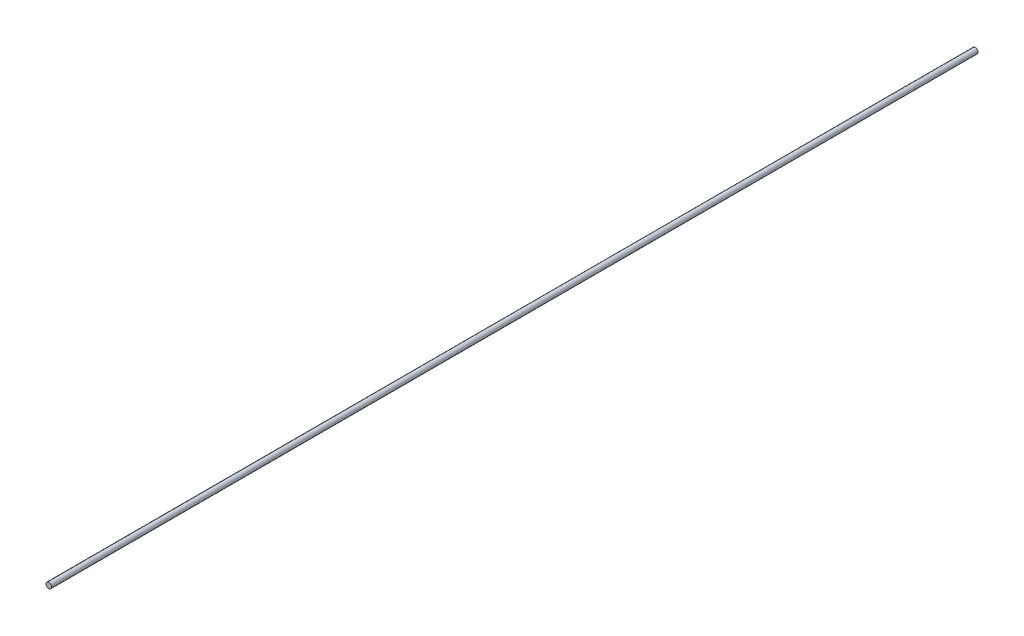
SolidWorks part; units mm, degrees
ref_plane "Face" through (0, 0, 0) normal (0, 0, 1) x (1, 0, 0)
ref_plane "Dessus" through (0, 0, 0) normal (0, 1, 0) x (1, 0, 0)
ref_plane "Droite" through (0, 0, 0) normal (1, 0, 0) x (0, 0, -1)
sketch "Esquisse1" plane through (0, 0, 0) normal (0, 0, 1) x (1, 0, 0)
  circle A0 centre (0, 0) radius 1.35
  dimension "D1" = 2.7
extrude "Extrusion1" add sketch "Esquisse1" along normal blind 450
